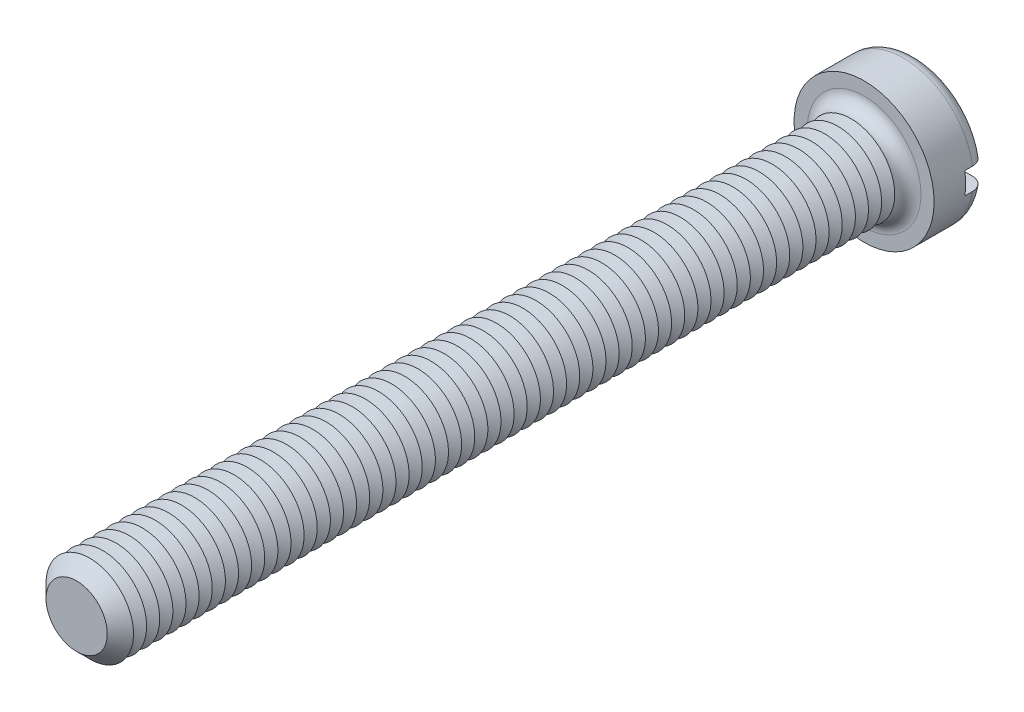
SolidWorks part; units mm, degrees
ref_plane "Front Plane" through (0, 0, 0) normal (0, 0, 1) x (1, 0, 0)
ref_plane "Top Plane" through (0, 0, 0) normal (0, 1, 0) x (1, 0, 0)
ref_plane "Right Plane" through (0, 0, 0) normal (1, 0, 0) x (0, 0, -1)
sketch "Sketch3" plane through (0, 0, 0) normal (0, 0, 1) x (1, 0, 0)
  circle A0 centre (0, 0) radius 8
  dimension "D1" = 16
extrude "Boss-Extrude2" add sketch "Sketch3" against normal blind 6
sketch "Sketch4" plane through (0, 0, 0) normal (0, 0, 1) x (1, 0, 0)
  circle A0 centre (0, 0) radius 5
  dimension "D1" = 10
extrude "Boss-Extrude3" add sketch "Sketch4" along normal blind 90
fillet "Fillet1" radius 1.5 2 edges at (8, 0, -6) (5, 0, 0)
chamfer "Chamfer1" distance 1.5 angle 45 1 edges at (5, 0, 90)
sketch "Sketch5" plane through (0, 0, 0) normal (1, 0, 0) x (0, 0, -1)
  line L0 (1.6944, 0) -> (-7.6738, 0) construction
sketch "Sketch6" plane through (0, 0, 0) normal (1, 0, 0) x (0, 0, -1)
  line L0 (-1.5, 5) -> (-2.25, 3.701)
  line L1 (-2.25, 3.701) -> (-3, 5)
  line L2 (-1.5, 5) -> (-88.5, 5) construction
  line L3 (-3, 5) -> (-1.5, 5)
  dimension "D1" = 1.5
revolve "Cut-Revolve1" cut sketch "Sketch6" angle 360 about L0
pattern_linear "LPattern1" count 58 spacing 1.5 along (0, 0, 1) of "Cut-Revolve1"
sketch "Sketch8" plane through (0, 0, -6) normal (0, 0, -1) x (-1, 0, 0)
  line L1 (8, -1.25) -> (-8, -1.25)
  line L2 (8, -1.25) -> (8, 1.25)
  line L3 (8, 1.25) -> (-8, 1.25)
  line L4 (-8, -1.25) -> (-8, 1.25)
  line L5 (8, -1.25) -> (-8, 1.25) construction
  line L6 (8, 1.25) -> (-8, -1.25) construction
  point P0 (0, 0)
  dimension "D1" = 16
  dimension "D2" = 2.5
extrude "Cut-Extrude1" cut sketch "Sketch8" against normal blind 2.4
